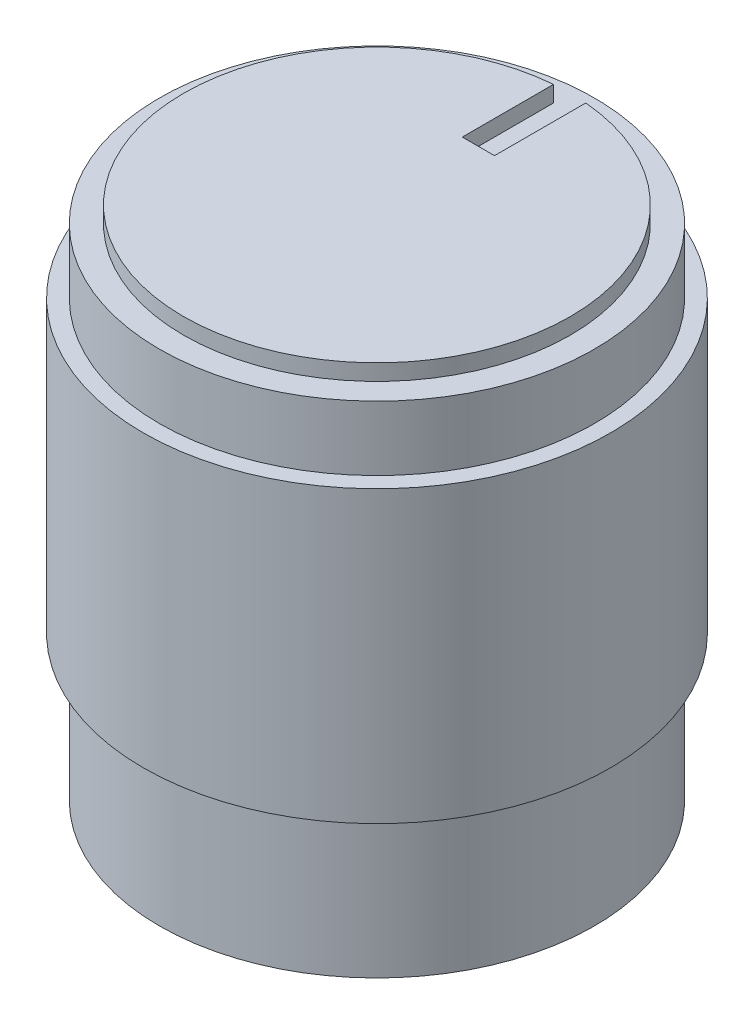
SolidWorks part; units mm, degrees
ref_plane "Спереди" through (0, 0, 0) normal (0, 0, 1) x (1, 0, 0)
ref_plane "Сверху" through (0, 0, 0) normal (0, 1, 0) x (1, 0, 0)
ref_plane "Справа" through (0, 0, 0) normal (1, 0, 0) x (0, 0, -1)
sketch "Эскиз1" plane through (0, 0, 0) normal (0, 1, 0) x (1, 0, 0)
  circle A0 centre (0, 0) radius 6.75
extrude "Бобышка-Вытянуть5" add sketch "Эскиз1" along normal blind 4.5
sketch "Эскиз7" plane through (0, 4.5, 0) normal (0, 1, 0) x (1, 0, 0)
  circle A0 centre (0, 0) radius 7.25
extrude "Бобышка-Вытянуть6" add sketch "Эскиз7" along normal blind 9
sketch "Эскиз8" plane through (0, 13.5, 0) normal (0, 1, 0) x (1, 0, 0)
  circle A0 centre (0, 0) radius 6.75
extrude "Бобышка-Вытянуть7" add sketch "Эскиз8" along normal blind 2
sketch "Эскиз9" plane through (0, 15.5, 0) normal (0, 1, 0) x (1, 0, 0)
  circle A0 centre (0, 0) radius 6
extrude "Бобышка-Вытянуть8" add sketch "Эскиз9" along normal blind 0.5
sketch "Эскиз10" plane through (0, 16, 0) normal (0, 1, 0) x (1, 0, 0)
  line L1 (-0.5, 3.148) -> (0.5, 3.148)
  line L2 (-0.5, 3.148) -> (-0.5, 6.0034)
  line L3 (-0.5, 6.0034) -> (0.5, 6.0034)
  line L4 (0.5, 3.148) -> (0.5, 6.0034)
extrude "Вырез-Вытянуть2" cut sketch "Эскиз10" against normal blind 0.5
sketch "Эскиз11" plane through (0, 0, 0) normal (0, -1, 0) x (1, 0, 0)
  circle A0 centre (0, 0) radius 6.25
extrude "Вырез-Вытянуть3" cut sketch "Эскиз11" against normal blind 5
sketch "Sketch1" plane through (0, 5, 0) normal (0, -1, 0) x (1, 0, 0)
  circle A0 centre (0, 0) radius 3
extrude "Cut-Extrude1" cut sketch "Sketch1" against normal blind 10
